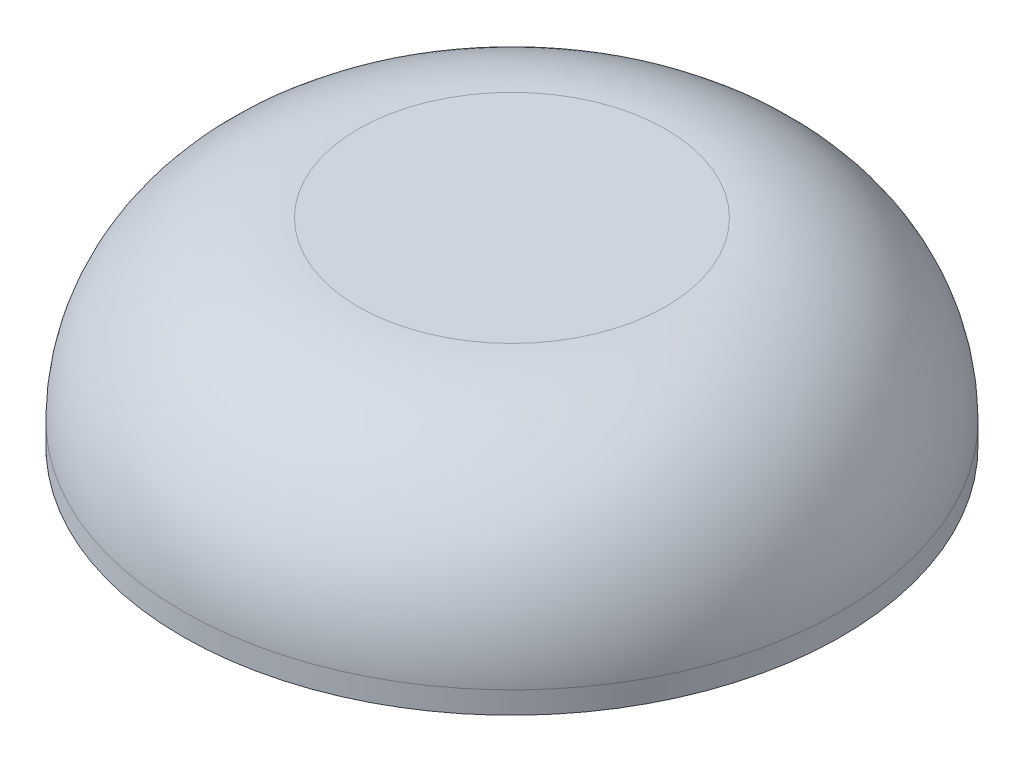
SolidWorks part; units mm, degrees
ref_plane "Plan de face" through (0, 0, 0) normal (0, 0, 1) x (1, 0, 0)
ref_plane "Plan de dessus" through (0, 0, 0) normal (0, 1, 0) x (1, 0, 0)
ref_plane "Plan de droite" through (0, 0, 0) normal (1, 0, 0) x (0, 0, -1)
sketch "Esquisse1" plane through (0, 0, 0) normal (0, 1, 0) x (1, 0, 0)
  circle A0 centre (0, 0) radius 7.5
  dimension "D1" = 15
extrude "Extrusion1" add sketch "Esquisse1" along normal blind 4.5
fillet "Congé1" radius 4 1 edges at (0, 4.5, 7.5)
